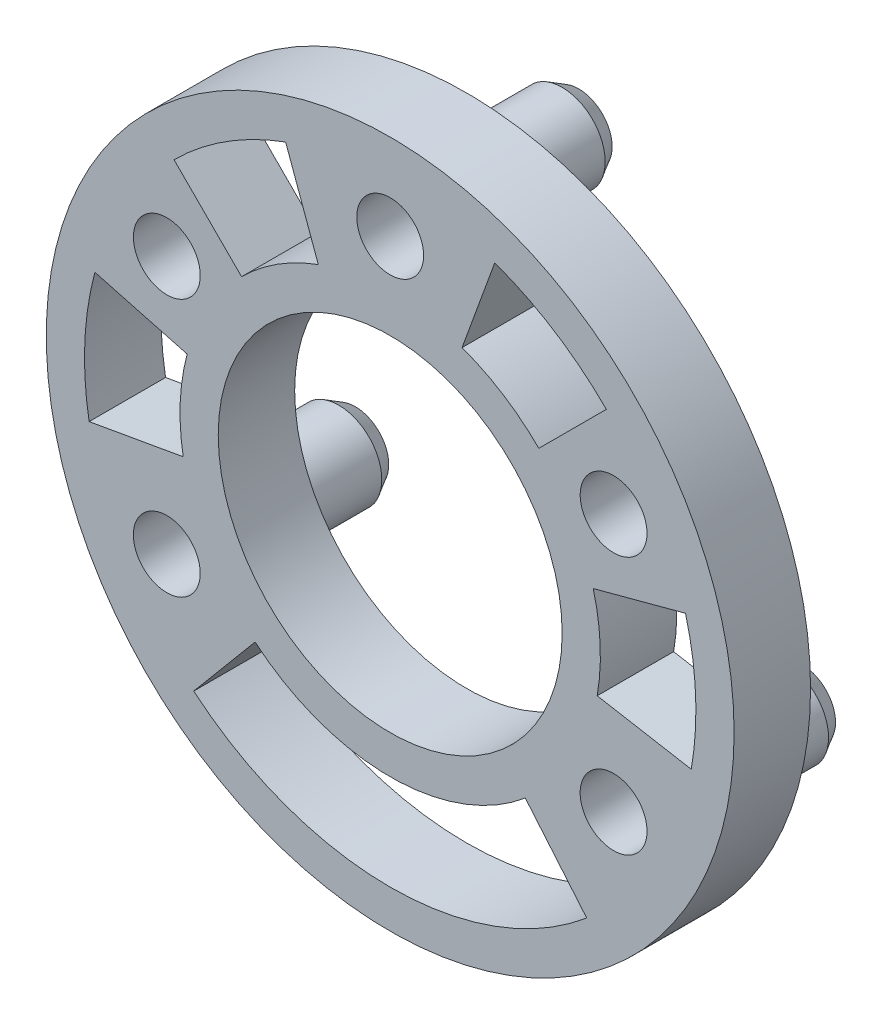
SolidWorks part; units mm, degrees
ref_plane "Front Plane" through (0, 0, 0) normal (0, 0, 1) x (1, 0, 0)
ref_plane "Top Plane" through (0, 0, 0) normal (0, 1, 0) x (1, 0, 0)
ref_plane "Right Plane" through (0, 0, 0) normal (1, 0, 0) x (0, 0, -1)
sketch "Sketch1" plane through (0, 0, 0) normal (0, 0, 1) x (1, 0, 0)
  line L0 (0, 0) -> (11.6913, -6.75) construction
  line L1 (0, 0) -> (-11.6913, -6.75) construction
  line L2 (0, -55) -> (0, 55) construction
  line L3 (-5.4723, 15.0351) -> (0, 0) construction
  line L4 (0, 0) -> (-15.7569, -2.7784) construction
  line L6 (-10.8329, -1.9101) -> (-15.7569, -2.7784)
  line L7 (-5.4723, 15.0351) -> (-3.7622, 10.3366)
  line L8 (15.7569, -2.7784) -> (10.8329, -1.9101)
  line L9 (3.7622, 10.3366) -> (5.4723, 15.0351)
  line L10 (-10.2846, -12.2567) -> (-7.0707, -8.4265)
  line L11 (7.0707, -8.4265) -> (10.2846, -12.2567)
  circle A0 centre (0, 0) radius 13.5 construction
  circle A1 centre (0, 13.5) radius 1.75
  circle A2 centre (-11.6913, -6.75) radius 1.75
  circle A3 centre (11.6913, -6.75) radius 1.75
  circle A4 centre (0, 0) radius 9
  circle A5 centre (0, 0) radius 18
  circle A6 centre (0, 0) radius 11 construction
  circle A7 centre (0, 0) radius 16 construction
  arc A8 (-10.8329, -1.9101) -> (-3.7622, 10.3366) centre (0, 0) cw
  arc A9 (-15.7569, -2.7784) -> (-5.4723, 15.0351) centre (0, 0) cw
  arc A10 (3.7622, 10.3366) -> (10.8329, -1.9101) centre (0, 0) cw
  arc A11 (5.4723, 15.0351) -> (15.7569, -2.7784) centre (0, 0) cw
  arc A12 (7.0707, -8.4265) -> (-7.0707, -8.4265) centre (0, 0) cw
  arc A13 (10.2846, -12.2567) -> (-10.2846, -12.2567) centre (0, 0) cw
  point P34 (0, 0)
  dimension "D1" = 27
  dimension "D4" = 3.5
  dimension "D5" = 18
  dimension "D6" = 36
  dimension "D7" = 2
  dimension "D8" = 2
  dimension "D2" = 120
  dimension "D3" = 120
  dimension "D9" = 20
  dimension "D10" = 20
  dimension "D11" = 3
extrude "Boss-Extrude1" add sketch "Sketch1" along normal blind 4
sketch "Sketch3" plane through (0, 0, 0) normal (0, 0, -1) x (-1, 0, 0)
  circle A0 centre (0, 13.5) radius 2.25
  circle A1 centre (-11.6913, -6.75) radius 2.25
  circle A2 centre (11.6913, -6.75) radius 2.25
  circle A3 centre (0, 13.5) radius 1.75
  circle A4 centre (-11.6913, -6.75) radius 1.75
  circle A5 centre (11.6913, -6.75) radius 1.75
  circle A6 centre (0, 13.5) radius 1.75 construction
  dimension "D1" = 4.5
extrude "Boss-Extrude2" add sketch "Sketch3" along normal blind 6 contours A0
sketch "Sketch5" plane through (0, 0, 4) normal (0, 0, 1) x (1, 0, 0)
  line L0 (-11.3137, 11.3137) -> (-7.7782, 7.7782)
  line L1 (-15.4548, 4.1411) -> (-10.6252, 2.847)
  line L2 (0, 0) -> (-15.5885, 9) construction
  line L3 (0, -2.2) -> (0, 2.2) construction
  line L4 (-11.3137, 11.3137) -> (0, 0) construction
  line L5 (-15.4548, 4.1411) -> (0, 0) construction
  arc A0 (-5.4723, 15.0351) -> (-15.7569, -2.7784) centre (0, 0) ccw construction
  arc A1 (-3.7622, 10.3366) -> (-10.8329, -1.9101) centre (0, 0) ccw construction
  circle A2 centre (0, 0) radius 13.5 construction
  arc A3 (-15.4548, 4.1411) -> (-11.3137, 11.3137) centre (0, 0) cw
  arc A4 (-10.6252, 2.847) -> (-7.7782, 7.7782) centre (0, 0) cw
  arc A5 (-13.04, 3.4941) -> (-9.5459, 9.5459) centre (0, 0) cw construction
  circle A6 centre (-11.6913, 6.75) radius 1.75
  circle A7 centre (0, 0) radius 18 construction
  point P13 (-9.5459, 9.5459)
  point P17 (0, 0)
  dimension "D1" = 3.5
  dimension "D2" = 60
  dimension "D3" = 30
extrude "Boss-Extrude4" add sketch "Sketch5" against normal up to surface (4 mm away)
mirror "Mirror1" about plane through (0, 0, 0) normal (1, 0, 0) of "Boss-Extrude4"
sketch "Sketch4" plane through (0, 0, 0) normal (0, 0, 1) x (1, 0, 0)
  line L0 (-12.7279, 12.7279) -> (12.7279, -12.7279) construction
  line L1 (2.2, 0) -> (-2.2, 0) construction
  line L2 (0, 0) -> (-15.1003, 9.797) construction
  line L3 (0, 0) -> (-9.797, 15.1003) construction
  line L4 (-15.1003, 9.797) -> (-18.0312, 12.7279)
  line L5 (-9.797, 15.1003) -> (-12.7279, 18.0312)
  line L6 (-18.0312, 12.7279) -> (-12.7279, 18.0312) construction
  line L7 (9.797, -15.1003) -> (12.7279, -18.0312)
  line L8 (15.1003, -9.797) -> (18.0312, -12.7279)
  circle A0 centre (0, 0) radius 18 construction
  circle A1 centre (0, 0) radius 18 construction
  arc A2 (-15.1003, 9.797) -> (-9.797, 15.1003) centre (0, 0) cw
  arc A3 (-18.0312, 12.7279) -> (-12.7279, 18.0312) centre (-15.3796, 15.3796) cw
  circle A4 centre (-15.3796, 15.3796) radius 1.75
  arc A5 (18.0312, -12.7279) -> (12.7279, -18.0312) centre (15.3796, -15.3796) cw
  arc A6 (15.1003, -9.797) -> (9.797, -15.1003) centre (0, 0) cw
  circle A7 centre (15.3796, -15.3796) radius 1.75
  point P25 (0, 0)
  dimension "D2" = 3.5
  dimension "D3" = 2
  dimension "D4" = 3.75
  dimension "D1" = 45
  dimension "D5" = 2
chamfer "Chamfer1" distance 1 angle 30 3 edges at (-13.9413, -6.75, -6) (9.4413, -6.75, -6) (-2.25, 13.5, -6)
